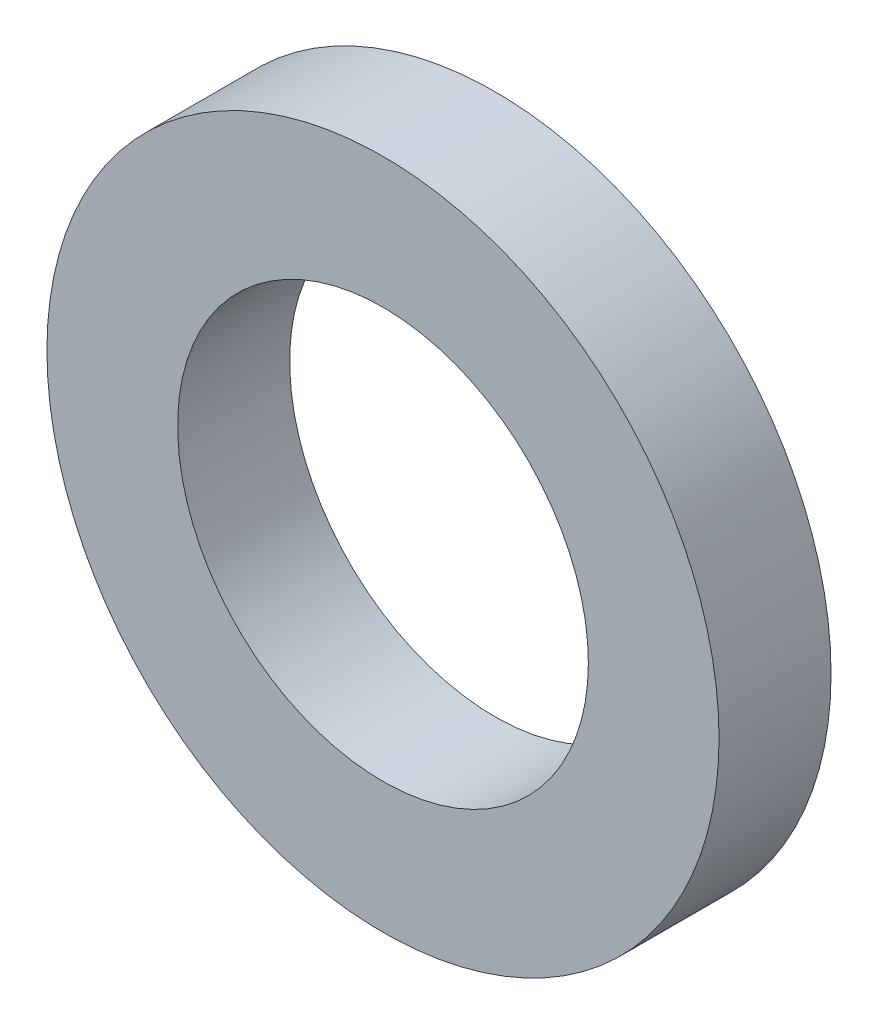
SolidWorks part; units mm, degrees
ref_plane "Plan1" through (0, 0, 0) normal (0, 0, 1) x (1, 0, 0)
ref_plane "Plan2" through (0, 0, 0) normal (0, 1, 0) x (1, 0, 0)
ref_plane "Plan3" through (0, 0, 0) normal (1, 0, 0) x (0, 0, -1)
sketch "Esquisse1" plane through (0, 0, 0) normal (0, 0, 1) x (1, 0, 0)
  circle A0 centre (0, 0) radius 4.5
  dimension "D1" = 9
extrude "Base-Extrusion" add sketch "Esquisse1" along normal blind 1.5
sketch "Esquisse2" plane through (0, 0, 1.5) normal (0, 0, 1) x (1, 0, 0)
  circle A0 centre (0, 0) radius 2.75
  dimension "D1" = 5.5
extrude "Enlèv. mat.-Extru.1" cut sketch "Esquisse2" against normal through all
